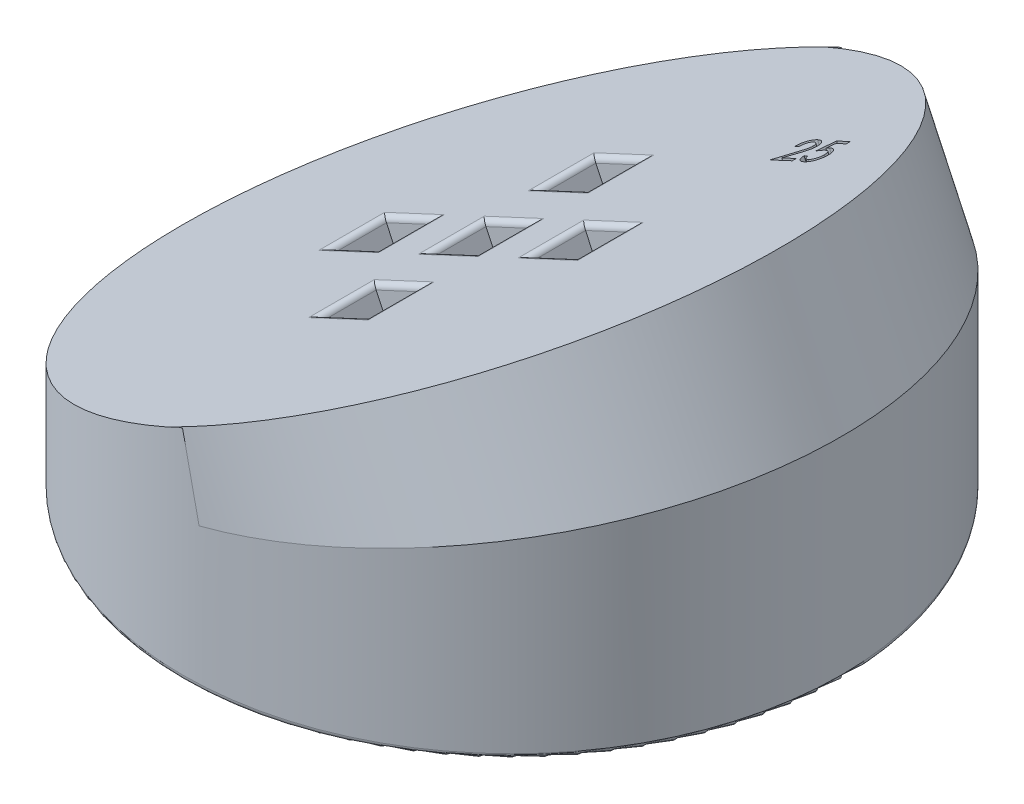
SolidWorks part; units mm, degrees
ref_plane "Front Plane" through (0, 0, 0) normal (0, 0, 1) x (1, 0, 0)
ref_plane "Top Plane" through (0, 0, 0) normal (0, 1, 0) x (1, 0, 0)
ref_plane "Right Plane" through (0, 0, 0) normal (1, 0, 0) x (0, 0, -1)
sketch "Sketch1" plane through (0, 0, 0) normal (0, 1, 0) x (1, 0, 0)
  circle A0 centre (0, 0) radius 30
extrude "Boss-Extrude1" add sketch "Sketch1" along normal blind 50
sketch "Sketch3" plane through (0, 50, 0) normal (0, 1, 0) x (1, 0, 0)
sketch "Sketch4" plane through (0, 0, 0) normal (0, -1, 0) x (-1, 0, 0)
  line L0 (0, 0) -> (-10, 0) construction
  line L1 (0, 0) -> (0, -10) construction
  line L2 (0, 0) -> (0, 10) construction
  line L3 (0, 0) -> (10, 0) construction
  line L5 (-2.5, 2.5) -> (2.5, 2.5)
  line L6 (-2.5, 2.5) -> (-2.5, -2.5)
  line L7 (-2.5, -2.5) -> (2.5, -2.5)
  line L8 (2.5, 2.5) -> (2.5, -2.5)
  line L9 (-2.5, 2.5) -> (2.5, -2.5) construction
  line L10 (-2.5, -2.5) -> (2.5, 2.5) construction
  line L11 (-2.5, -7.5) -> (2.5, -7.5)
  line L12 (-2.5, -7.5) -> (-2.5, -12.5)
  line L13 (-2.5, -12.5) -> (2.5, -12.5)
  line L14 (2.5, -7.5) -> (2.5, -12.5)
  line L15 (-2.5, -7.5) -> (2.5, -12.5) construction
  line L16 (-2.5, -12.5) -> (2.5, -7.5) construction
  line L17 (7.5, 2.5) -> (12.5, 2.5)
  line L18 (7.5, 2.5) -> (7.5, -2.5)
  line L19 (7.5, -2.5) -> (12.5, -2.5)
  line L20 (12.5, 2.5) -> (12.5, -2.5)
  line L21 (7.5, 2.5) -> (12.5, -2.5) construction
  line L22 (7.5, -2.5) -> (12.5, 2.5) construction
  line L23 (-12.5, 2.5) -> (-7.5, 2.5)
  line L24 (-12.5, 2.5) -> (-12.5, -2.5)
  line L25 (-12.5, -2.5) -> (-7.5, -2.5)
  line L26 (-7.5, 2.5) -> (-7.5, -2.5)
  line L27 (-12.5, 2.5) -> (-7.5, -2.5) construction
  line L28 (-12.5, -2.5) -> (-7.5, 2.5) construction
  line L29 (2.5, 7.5) -> (-2.5, 7.5)
  line L30 (2.5, 7.5) -> (2.5, 12.5)
  line L31 (2.5, 12.5) -> (-2.5, 12.5)
  line L32 (-2.5, 7.5) -> (-2.5, 12.5)
  line L33 (2.5, 7.5) -> (-2.5, 12.5) construction
  line L34 (2.5, 12.5) -> (-2.5, 7.5) construction
  dimension "D1" = 5
  dimension "D2" = 5
  dimension "D3" = 5
  dimension "D4" = 5
  dimension "D5" = 5
  dimension "D6" = 5
extrude "Cut-Extrude2" cut sketch "Sketch4" against normal blind 3
fillet "Fillet2" radius 0.5 21 edges at (0, 0, 30) (2.5, 0, 0) (0, 0, 2.5) (-2.5, 0, 0) (0, 0, -2.5) (2.5, 0, 10) (0, 0, 12.5) (-2.5, 0, 10) (0, 0, 7.5) (-7.5, 0, 0) (-10, 0, 2.5) (-12.5, 0, 0) (-10, 0, -2.5) (12.5, 0, 0) (10, 0, 2.5) (7.5, 0, 0) (10, 0, -2.5) (-2.5, 0, -10) (0, 0, -12.5) (2.5, 0, -10) (0, 0, -7.5)
ref_plane "Plane6" through (0, 0, 3.5) normal (0, 0, 1) x (1, 0, 0)
sketch "Sketch13" plane through (0, 0, 3.5) normal (0, 0, 1) x (1, 0, 0)
  line L0 (-30, 6) -> (30, 33.9785)
  line L1 (-30, 50) -> (-30, 0.5) construction
  line L2 (30, 0.5) -> (30, 50) construction
  line L3 (30, 33.9785) -> (30, 50)
  line L4 (30, 50) -> (-30, 50)
  line L5 (-30, 50) -> (-30, 6)
  line L6 (30, 0.5) -> (-30, 0.5) construction
  dimension "D1" = 5.5
  dimension "D2" = 25
extrude "Cut-Extrude10" cut sketch "Sketch13" against normal mid plane 90
ref_plane "Plane4" through (0, 0, -2.5) normal (0, 0, -1) x (-1, 0, 0)
ref_plane "Plane5" through (0, 0, -62.5) normal (0, 0, -1) x (-1, 0, 0)
sketch "Sketch15" plane through (-7.6563, 16.419, 0) normal (-0.4226, 0.9063, 0) x (0.9063, 0.4226, 0)
  line L0 (-24.6535, 0) -> (0, 0) construction
  line L2 (-2.1535, -2.5) -> (-7.1535, -2.5)
  line L3 (-2.1535, -2.5) -> (-2.1535, 2.5)
  line L4 (-2.1535, 2.5) -> (-7.1535, 2.5)
  line L5 (-7.1535, -2.5) -> (-7.1535, 2.5)
  line L6 (-2.1535, -2.5) -> (-7.1535, 2.5) construction
  line L7 (-2.1535, 2.5) -> (-7.1535, -2.5) construction
  line L8 (7.8465, -2.5) -> (2.8465, -2.5)
  line L9 (7.8465, -2.5) -> (7.8465, 2.5)
  line L10 (7.8465, 2.5) -> (2.8465, 2.5)
  line L11 (2.8465, -2.5) -> (2.8465, 2.5)
  line L12 (7.8465, -2.5) -> (2.8465, 2.5) construction
  line L13 (7.8465, 2.5) -> (2.8465, -2.5) construction
  line L14 (17.8465, -2.5) -> (12.8465, -2.5)
  line L15 (17.8465, -2.5) -> (17.8465, 2.5)
  line L16 (17.8465, 2.5) -> (12.8465, 2.5)
  line L17 (12.8465, -2.5) -> (12.8465, 2.5)
  line L18 (17.8465, -2.5) -> (12.8465, 2.5) construction
  line L19 (17.8465, 2.5) -> (12.8465, -2.5) construction
  line L20 (7.8465, -12.5) -> (2.8465, -12.5)
  line L21 (7.8465, -12.5) -> (7.8465, -7.5)
  line L22 (7.8465, -7.5) -> (2.8465, -7.5)
  line L23 (2.8465, -12.5) -> (2.8465, -7.5)
  line L24 (7.8465, -12.5) -> (2.8465, -7.5) construction
  line L25 (7.8465, -7.5) -> (2.8465, -12.5) construction
  line L26 (7.8465, 7.5) -> (2.8465, 7.5)
  line L27 (7.8465, 7.5) -> (7.8465, 12.5)
  line L28 (7.8465, 12.5) -> (2.8465, 12.5)
  line L29 (2.8465, 7.5) -> (2.8465, 12.5)
  line L30 (7.8465, 7.5) -> (2.8465, 12.5) construction
  line L31 (7.8465, 12.5) -> (2.8465, 7.5) construction
  ellipse E0 centre (8.4478, 0) end of major axis (-24.6535, 0) minor radius 30 construction
  point P9 (-4.6535, 0)
  point P14 (5.3465, 0)
  point P19 (15.3465, 0)
  point P24 (5.3465, -10)
  point P29 (5.3465, 10)
  dimension "D1" = 40
  dimension "D2" = 30
  dimension "D3" = 20
  dimension "D4" = 5
  dimension "D5" = 5
  dimension "D6" = 5
  dimension "D7" = 5
  dimension "D8" = 5
  dimension "D9" = 5
  dimension "D10" = 5
  dimension "D11" = 5
  dimension "D12" = 10
  dimension "D13" = 10
  dimension "D14" = 5
  dimension "D15" = 5
extrude "Cut-Extrude11" cut sketch "Sketch15" against normal blind 3
ref_plane "Plane7" through (0, 0, 0) normal (0, 0, -1) x (-1, 0, 0)
sketch "Sketch24" plane through (-7.6563, 16.419, 0) normal (-0.4226, 0.9063, 0) x (0.9063, 0.4226, 0)
  line L0 (5.3465, -30) -> (35.1643, -35.8499)
  line L1 (5.3465, 0) -> (-24.6535, 0)
  line L3 (35.1643, -35.8499) -> (45.7239, 0)
  line L4 (45.7239, 0) -> (28.8644, 38.5482)
  line L5 (28.8644, 38.5482) -> (5.3465, 34.4662)
  line L6 (5.3465, 34.4662) -> (5.3465, 30)
  arc A0 (5.3465, -30) -> (-24.6535, 0) centre (5.3465, 0) ccw
  ellipse E1 centre (8.4478, 0) end of major axis (-24.6535, 0) minor radius 30 construction
  dimension "D1" = 30
extrude "Cut-Extrude13" cut sketch "Sketch24" against normal blind 100 contours A0 M21
fillet "Fillet8" radius 0.5 4 edges at (-2.8108, 18.6785, -7.5) (-0.545, 19.7351, -10) (-2.8108, 18.6785, -12.5) (-5.0765, 17.622, -10)
fillet "Fillet9" radius 0.5 4 edges at (6.2523, 22.9047, 2.5) (8.5181, 23.9613, 0) (6.2523, 22.9047, -2.5) (3.9865, 21.8482, 0)
fillet "Fillet10" radius 0.5 4 edges at (-14.1396, 13.3958, 0) (-11.8738, 14.4524, 2.5) (-9.6081, 15.5089, 0) (-11.8738, 14.4524, -2.5)
fillet "Fillet11" radius 0.5 4 edges at (-5.0765, 17.622, 10) (-2.8108, 18.6785, 12.5) (-0.545, 19.7351, 10) (-2.8108, 18.6785, 7.5)
fillet "Fillet12" radius 0.5 4 edges at (-5.0765, 17.622, 0) (-2.8108, 18.6785, 2.5) (-0.545, 19.7351, 0) (-2.8108, 18.6785, -2.5)
sketch "Sketch25" plane through (-7.6563, 16.419, 0) normal (-0.4226, 0.9063, 0) x (0.9063, 0.4226, 0)
  text T0 "<b>25</b>"
extrude "Cut-Extrude14" cut sketch "Sketch25" against normal blind 4
